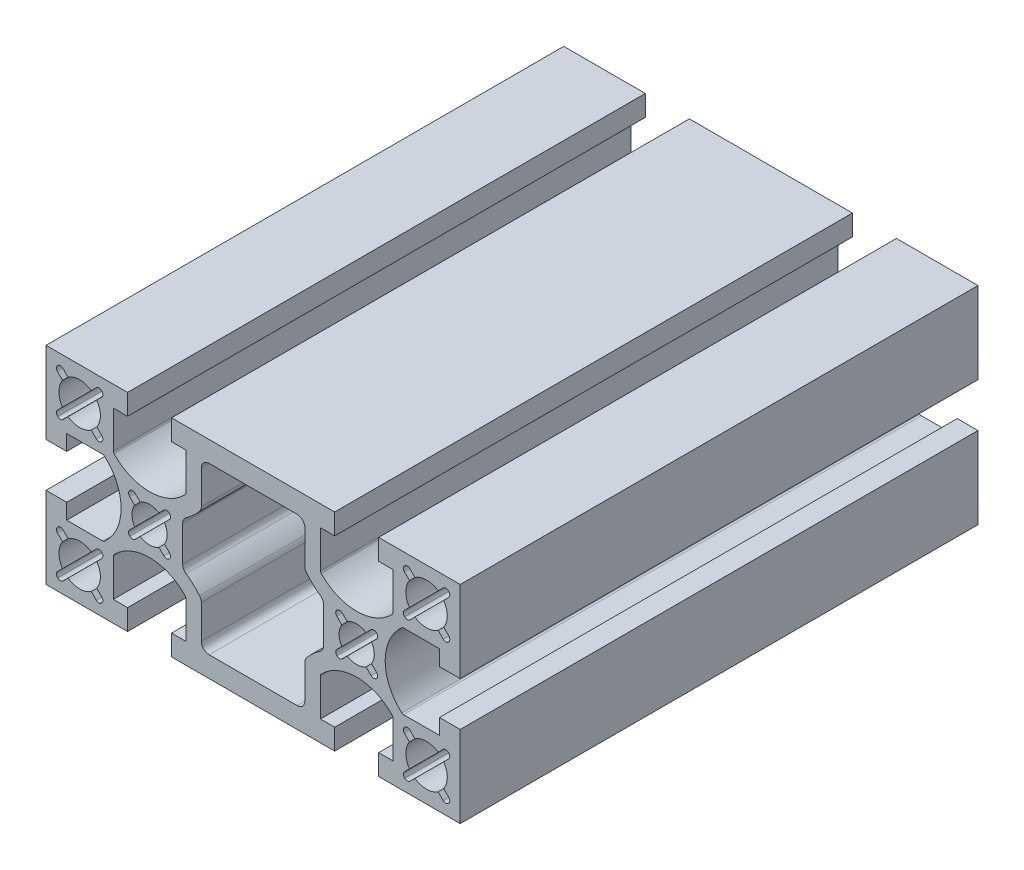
SolidWorks part; units mm, degrees
ref_plane "前基準面" through (0, 0, 0) normal (0, 0, 1) x (1, 0, 0)
ref_plane "上基準面" through (0, 0, 0) normal (0, 1, 0) x (1, 0, 0)
ref_plane "右基準面" through (0, 0, 0) normal (1, 0, 0) x (0, 0, -1)
sketch "草圖1" plane through (0, 0, 0) normal (0, 0, 1) x (1, 0, 0)
  line L0 (0, 53.2301) -> (0, -51.0629) construction
  line L2 (-40, 20) -> (40, 20)
  line L3 (-40, 20) -> (-40, -20)
  line L4 (-40, -20) -> (40, -20)
  line L5 (40, 20) -> (40, -20)
  line L6 (-40, 20) -> (40, -20) construction
  line L7 (-40, -20) -> (40, 20) construction
  point P3 (0, 0)
  dimension "D1" = 80
  dimension "D2" = 40
extrude "填料-伸長1" add sketch "草圖1" along normal mid plane 100
sketch "草圖2" plane through (0, 0, 50) normal (0, 0, 1) x (1, 0, 0)
  circle A0 centre (-20, 0) radius 3.4
  circle A1 centre (20, 0) radius 3.4
  dimension "D1" = 40
  dimension "D3" = 6.8
  dimension "D2" = 20
extrude "除料-伸長1" cut sketch "草圖2" against normal through all
sketch "草圖3" plane through (0, 0, 50) normal (0, 0, 1) x (1, 0, 0)
  line L0 (-33.5, 13.5) -> (33.5, 13.5) construction
  circle A0 centre (-33.5, 13.5) radius 4
  circle A2 centre (33.5, 13.5) radius 4
  circle A3 centre (33.5, -13.5) radius 4
  circle A4 centre (-33.5, -13.5) radius 4
  dimension "D2" = 8
  dimension "D1" = 33.5
  dimension "D3" = 13.5
  dimension "D5" = 67
  dimension "D4" = 2
extrude "除料-伸長2" cut sketch "草圖3" against normal through all
sketch "草圖4" plane through (0, 0, 50) normal (0, 0, 1) x (1, 0, 0)
  line L0 (20, 20) -> (20, 10) construction
  line L1 (40, 20) -> (-40, 20) construction
  line L2 (40, 20) -> (20, 20) construction
  line L3 (15.75, 20) -> (24.25, 20)
  line L4 (13, 16) -> (13, 8.7751)
  line L5 (15.75, 16) -> (13, 16)
  line L6 (15.75, 20) -> (15.75, 16)
  line L10 (24.25, 20) -> (24.25, 16)
  line L11 (27, 16) -> (27, 8.7751)
  line L15 (24.25, 16) -> (27, 16)
  arc A0 (26.8611, 8.4292) -> (27, 8.7751) centre (26.5, 8.7751) ccw
  arc A1 (13, 8.7751) -> (13.1389, 8.4292) centre (13.5, 8.7751) ccw
  arc A3 (13.1389, 8.4292) -> (26.8611, 8.4292) centre (20, 15) ccw
  point P10 (27, 8.5774)
  point P14 (13, 8.5774)
  dimension "D1" = 20
  dimension "D6" = 9.5
  dimension "D4" = 8.5
  dimension "D5" = 4
  dimension "D7" = 5
  dimension "D2" = 0.5
  dimension "D3" = 14
extrude "除料-伸長3" cut sketch "草圖4" against normal through all
mirror "鏡射1" about plane through (0, 0, 0) normal (0, 1, 0) of "除料-伸長3"
pattern_linear "直線複製排列1" count 2 spacing 40 along (-1, 0, 0) of "鏡射1", "除料-伸長3"
sketch "草圖5" plane through (0, 0, 50) normal (0, 0, 1) x (1, 0, 0)
  line L0 (0, 0) -> (-40, 0) construction
  line L1 (-40, 20) -> (-40, -20) construction
  line L2 (-40, -4.25) -> (-40, 4.25)
  line L3 (-40, 4.25) -> (-36, 4.25)
  line L4 (-36, 4.25) -> (-36, 7.25)
  line L5 (-36, 7.25) -> (-29.0471, 7.25)
  line L6 (-40, -4.25) -> (-36, -4.25)
  line L7 (-36, -4.25) -> (-36, -7.25)
  line L8 (-36, -7.25) -> (-29.0471, -7.25)
  arc A0 (-28.7163, -7.125) -> (-28.7163, 7.125) centre (-35, 0) ccw
  arc A1 (-29.0471, 7.25) -> (-28.7163, 7.125) centre (-29.0471, 6.75) cw
  arc A2 (-29.0471, -7.25) -> (-28.7163, -7.125) centre (-29.0471, -6.75) ccw
  dimension "D4" = 9.5
  dimension "D5" = 0.5
  dimension "D1" = 4
  dimension "D2" = 8.5
  dimension "D3" = 14.5
  dimension "D6" = 5
extrude "除料-伸長4" cut sketch "草圖5" against normal through all
mirror "鏡射2" about plane through (0, 0, 0) normal (1, 0, 0) of "除料-伸長4"
sketch "草圖7" plane through (0, 0, 50) normal (0, 0, 1) x (1, 0, 0)
  line L0 (-8.5, 16) -> (8.5, 16)
  line L1 (10, 14.5) -> (10, 8.0179)
  line L2 (-13.6, 0) -> (13.6, 0) construction
  line L3 (13.6, 3.4419) -> (13.6, -3.4419)
  line L4 (0, -16) -> (0, 16) construction
  line L5 (15.75, 16) -> (13, 16) construction
  line L6 (13, 16) -> (13, 8.7751) construction
  line L7 (-13.6, 3.4419) -> (-13.6, -3.4419)
  line L8 (-10, 14.5) -> (-10, 8.0179)
  line L9 (-10, -14.5) -> (-10, -8.0179)
  line L10 (10, -14.5) -> (10, -8.0179)
  line L11 (-8.5, -16) -> (8.5, -16)
  circle A0 centre (20, 0) radius 3.4 construction
  arc A2 (13.1389, 8.4292) -> (26.8611, 8.4292) centre (20, 15) ccw construction
  arc A3 (-10.3409, 7.0658) -> (-12.9464, 4.6803) centre (-20, 15) cw
  arc A4 (10.3409, 7.0658) -> (12.9464, 4.6803) centre (20, 15) ccw
  arc A5 (10.3409, -7.0658) -> (12.9464, -4.6803) centre (20, -15) cw
  arc A6 (-10.3409, -7.0658) -> (-12.9464, -4.6803) centre (-20, -15) ccw
  arc A7 (-10, 14.5) -> (-8.5, 16) centre (-8.5, 14.5) cw
  arc A8 (-10.3409, 7.0658) -> (-10, 8.0179) centre (-11.5, 8.0179) ccw
  arc A9 (-12.9464, 4.6803) -> (-13.6, 3.4419) centre (-12.1, 3.4419) ccw
  arc A10 (-12.9464, -4.6803) -> (-13.6, -3.4419) centre (-12.1, -3.4419) cw
  arc A11 (-10.3409, -7.0658) -> (-10, -8.0179) centre (-11.5, -8.0179) cw
  arc A12 (-10, -14.5) -> (-8.5, -16) centre (-8.5, -14.5) ccw
  arc A13 (10, -14.5) -> (8.5, -16) centre (8.5, -14.5) cw
  arc A14 (10.3409, -7.0658) -> (10, -8.0179) centre (11.5, -8.0179) ccw
  arc A15 (12.9464, -4.6803) -> (13.6, -3.4419) centre (12.1, -3.4419) ccw
  arc A16 (13.6, 3.4419) -> (12.9464, 4.6803) centre (12.1, 3.4419) ccw
  arc A17 (10, 8.0179) -> (10.3409, 7.0658) centre (11.5, 8.0179) ccw
  arc A18 (8.5, 16) -> (10, 14.5) centre (8.5, 14.5) cw
  point P23 (0, 0)
  point P33 (-10, 16)
  point P36 (-10, 7.5)
  point P39 (-13.6, 4.2627)
  point P42 (-13.6, -4.2627)
  point P45 (-10, -7.5)
  point P48 (-10, -16)
  point P51 (10, -16)
  point P54 (10, -7.5)
  point P57 (13.6, -4.2627)
  point P60 (13.6, 4.2627)
  point P63 (10, 7.5)
  point P66 (10, 16)
  dimension "D3" = 3
  dimension "D4" = 1.5
  dimension "D1" = 3
  dimension "D2" = 6.4
extrude "除料-伸長5" cut sketch "草圖7" against normal through all
sketch "草圖8" plane through (0, 0, 50) normal (0, 0, 1) x (1, 0, 0)
  line L0 (-31.2521, 16.8086) -> (-29.821, 18.2397)
  line L1 (-30.1914, 15.7479) -> (-28.7603, 17.179)
  line L2 (-30.1914, 11.2521) -> (-28.7603, 9.821)
  line L3 (-31.2521, 10.1914) -> (-29.821, 8.7603)
  line L4 (-35.7479, 10.1914) -> (-37.179, 8.7603)
  line L5 (-36.8086, 11.2521) -> (-38.2397, 9.821)
  line L12 (-36.8086, 15.7479) -> (-38.2397, 17.179)
  line L14 (-35.7479, 16.8086) -> (-37.179, 18.2397)
  line L16 (-35.7479, 16.8086) -> (-37.179, 18.2397)
  line L18 (-35.7479, 16.8086) -> (-37.179, 18.2397)
  line L20 (-35.7479, 16.8086) -> (-37.179, 18.2397)
  line L28 (-37.7426, 17.7426) -> (-40, 20) construction
  circle A0 centre (-33.5, 13.5) radius 4 construction
  arc A1 (-28.7603, 17.179) -> (-29.821, 18.2397) centre (-33.5, 13.5) ccw
  circle A2 centre (-33.5, 13.5) radius 6
  arc A3 (-37.179, 18.2397) -> (-38.2397, 17.179) centre (-33.5, 13.5) ccw
  arc A4 (-29.821, 8.7603) -> (-28.7603, 9.821) centre (-33.5, 13.5) ccw
  arc A5 (-38.2397, 9.821) -> (-37.179, 8.7603) centre (-33.5, 13.5) ccw
  arc A6 (-36.8086, 15.7479) -> (-36.8086, 11.2521) centre (-33.5, 13.5) ccw
  arc A7 (-31.2521, 16.8086) -> (-35.7479, 16.8086) centre (-33.5, 13.5) ccw
  arc A8 (-30.1914, 11.2521) -> (-30.1914, 15.7479) centre (-33.5, 13.5) ccw
  arc A9 (-35.7479, 10.1914) -> (-31.2521, 10.1914) centre (-33.5, 13.5) ccw
  point P26 (-33.5, 13.5)
  point P31 (-33.5, 13.5)
  dimension "D1" = 0.75
  dimension "D2" = 0.75
  dimension "D3" = 4
  dimension "D6" = 2
extrude "除料-伸長6" cut sketch "草圖8" against normal through all
fillet "圓角1" radius 0.7 8 edges at (-37.179, 18.2397, 0) (-38.2397, 17.179, 0) (-38.2397, 9.821, 0) (-37.179, 8.7603, 0) (-29.821, 8.7603, 0) (-28.7603, 9.821, 0) (-28.7603, 17.179, 0) (-29.821, 18.2397, 0)
pattern_linear "直線複製排列2" count 2 spacing 67 along (1, 0, 0) count 2 spacing 27 along (0, -1, 0) of "除料-伸長6", "圓角1"
sketch "草圖9" plane through (0, 0, 50) normal (0, 0, 1) x (1, 0, 0)
  line L0 (-20, 0) -> (-23.8184, 3.8184) construction
  line L1 (-18.1854, 2.8753) -> (-17.2352, 3.8254)
  line L2 (-22.8753, 1.8146) -> (-23.8254, 2.7648)
  line L3 (-20, 0) -> (-20, 5.4) construction
  line L4 (-20.5303, -0.5303) -> (-40.5303, 19.4697) construction
  line L5 (-20, 0) -> (-40, 20) construction
  line L6 (-17.1247, 1.8146) -> (-16.1746, 2.7648)
  line L7 (-21.8146, 2.8753) -> (-22.7648, 3.8254)
  line L8 (-17.1247, -1.8146) -> (-16.1746, -2.7648)
  line L9 (-18.1854, -2.8753) -> (-17.2352, -3.8254)
  line L10 (-21.8146, -2.8753) -> (-22.7648, -3.8254)
  line L11 (-22.8753, -1.8146) -> (-23.8254, -2.7648)
  circle A1 centre (-20, 0) radius 3.4 construction
  circle A2 centre (-20, 0) radius 5.4
  arc A3 (-23.8102, 3.8266) -> (-23.8266, 3.8102) centre (-20, 0) ccw
  arc A4 (-22.8753, 1.8146) -> (-22.8753, -1.8146) centre (-20, 0) ccw
  arc A5 (-22.7648, 3.8254) -> (-23.8102, 3.8266) centre (-23.288, 3.3022) ccw
  arc A6 (-23.8266, 3.8102) -> (-23.8254, 2.7648) centre (-23.3022, 3.288) ccw
  arc A7 (-16.1898, 3.8266) -> (-17.2352, 3.8254) centre (-16.712, 3.3022) ccw
  arc A8 (-16.1734, 3.8102) -> (-16.1898, 3.8266) centre (-20, 0) ccw
  arc A9 (-16.1746, 2.7648) -> (-16.1734, 3.8102) centre (-16.6978, 3.288) ccw
  arc A10 (-16.1734, -3.8102) -> (-16.1746, -2.7648) centre (-16.6978, -3.288) ccw
  arc A11 (-16.1898, -3.8266) -> (-16.1734, -3.8102) centre (-20, 0) ccw
  arc A12 (-17.2352, -3.8254) -> (-16.1898, -3.8266) centre (-16.712, -3.3022) ccw
  arc A13 (-23.8102, -3.8266) -> (-22.7648, -3.8254) centre (-23.288, -3.3022) ccw
  arc A14 (-23.8266, -3.8102) -> (-23.8102, -3.8266) centre (-20, 0) ccw
  arc A15 (-23.8254, -2.7648) -> (-23.8266, -3.8102) centre (-23.3022, -3.288) ccw
  arc A16 (-18.1854, 2.8753) -> (-21.8146, 2.8753) centre (-20, 0) ccw
  arc A17 (-17.1247, -1.8146) -> (-17.1247, 1.8146) centre (-20, 0) ccw
  arc A18 (-21.8146, -2.8753) -> (-18.1854, -2.8753) centre (-20, 0) ccw
  point P44 (-20, 0)
  dimension "D2" = 0.74
  dimension "D4" = 45
  dimension "D1" = 2
  dimension "D3" = 0.75
  dimension "D5" = 4
extrude "除料-伸長7" cut sketch "草圖9" against normal through all
pattern_linear "直線複製排列3" count 2 spacing 40 along (1, 0, 0) of "除料-伸長7"
